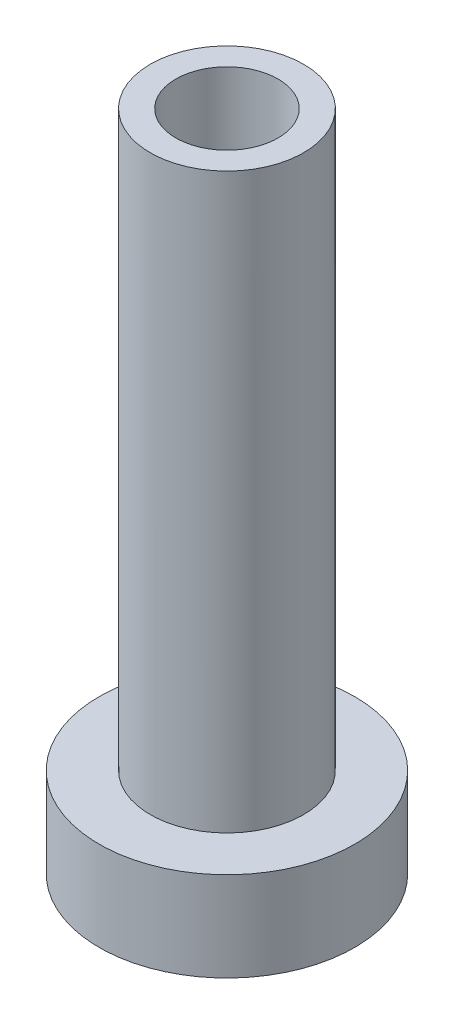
SolidWorks part; units mm, degrees
ref_plane "Plan de face" through (0, 0, 0) normal (0, 0, 1) x (1, 0, 0)
ref_plane "Plan de dessus" through (0, 0, 0) normal (0, 1, 0) x (1, 0, 0)
ref_plane "Plan de droite" through (0, 0, 0) normal (1, 0, 0) x (0, 0, -1)
sketch "Esquisse1" plane through (0, 0, 0) normal (0, 0, 1) x (1, 0, 0)
  line L0 (0, 0) -> (0, 67.7263) construction
  line L1 (-4, 0) -> (-10, 0)
  line L2 (55, 0) -> (-55, 0) construction
  line L3 (-10, 0) -> (-10, 7)
  line L4 (-10, 7) -> (-6, 7)
  line L5 (-6, 7) -> (-6, 75)
  line L6 (-6, 75) -> (-4, 75)
  line L7 (-4, 75) -> (-4, 0)
  dimension "D1" = 20
  dimension "D2" = 12
  dimension "D3" = 7
  dimension "D4" = 8
  dimension "D5" = 75
revolve "Révolution1" add sketch "Esquisse1" angle 360 about L0
sketch "Esquisse2" plane through (0, 0, 0) normal (0, 1, 0) x (1, 0, 0)
  circle A0 centre (0, 0) radius 4.25
  dimension "D1" = 8.5
extrude "Enlèv. mat.-Extru.1" cut sketch "Esquisse2" along normal blind 40
chamfer "Chanfrein1" distance 1 angle 45 1 edges at (0, 0, 4.25)
sketch "Esquisse3" plane through (0, 75, 0) normal (0, 1, 0) x (1, 0, 0)
  circle A0 centre (0, 0) radius 6 construction
  circle A1 centre (0, 0) radius 6
extrude "Enlèv. mat.-Extru.2" cut sketch "Esquisse3" against normal up to surface (23.15 mm away)
